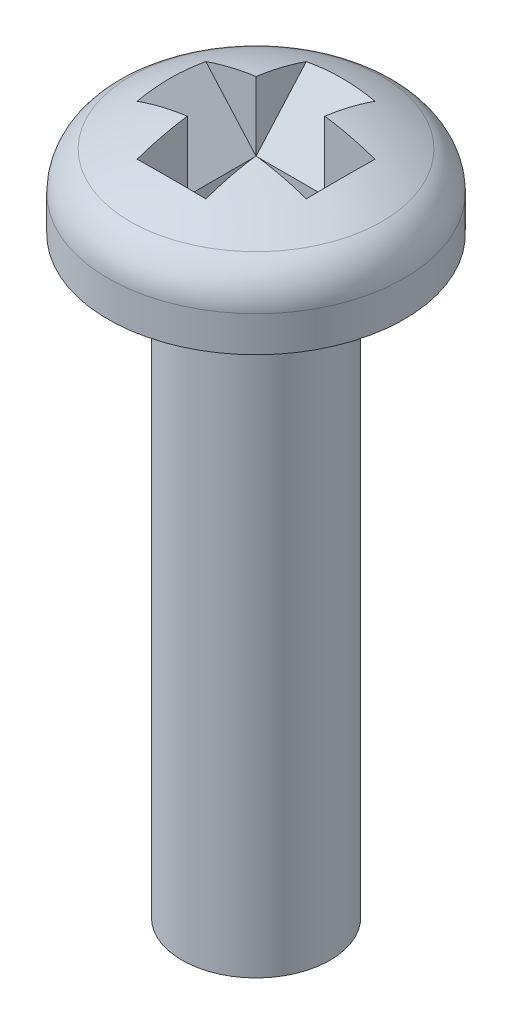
SolidWorks part; units mm, degrees
ref_plane "Plane1" through (0, 0, 0) normal (0, 0, 1) x (1, 0, 0)
ref_plane "Plane2" through (0, 0, 0) normal (0, 1, 0) x (1, 0, 0)
ref_plane "Plane3" through (0, 0, 0) normal (1, 0, 0) x (0, 0, -1)
sketch "Sketch1" plane through (0, 0, 0) normal (0, 0, 1) x (1, 0, 0)
  line L0 (0, 0) -> (3.175, 0)
  line L1 (3.175, 0) -> (3.175, 0.762)
  line L2 (0, 2.286) -> (0, 0)
  line L3 (0, 0) -> (0, 6.1523) construction
  arc A0 (3.175, 0.762) -> (2.6988, 1.5774) centre (2.2389, 0.762) ccw
  arc A1 (2.6988, 1.5774) -> (0, 2.286) centre (0, -3.2074) ccw
  dimension "D3" = 0.9361
  dimension "D1" = 3.175
  dimension "D2" = 1.524
  dimension "D4" = 0.762
revolve "Base-Revolve" add sketch "Sketch1" angle 360 about L3
sketch "Sketch2" plane through (0, 0, 0) normal (0, 0, 1) x (1, 0, 0)
  line L0 (0, 0) -> (0, 100) construction
  line L1 (0, -12.7) -> (1.5875, -12.7)
  line L2 (1.5875, -12.7) -> (1.5875, 0)
  line L3 (1.5875, 0) -> (0, 0)
  line L4 (0, 0) -> (0, -12.7)
  dimension "D1" = 12.7
  dimension "D2" = 1.5875
revolve "Boss-Revolve1" add sketch "Sketch2" angle 360 about L0
sketch "Sketch3" plane through (0, 0, 0) normal (0, 0, 1) x (1, 0, 0)
  line L0 (-4.0386, 6.6675) -> (4.0386, 6.6675)
  line L1 (4.0386, 6.6675) -> (4.0386, 4.445)
  line L2 (4.0386, 4.445) -> (0, -0.127)
  line L3 (0, -0.127) -> (-4.0386, 4.445)
  line L4 (-4.0386, 4.445) -> (-4.0386, 6.6675)
extrude "Cut-Extrude1" cut sketch "Sketch3" against normal mid plane 1.4732
sketch "Sketch4" plane through (0, 0, 0) normal (1, 0, 0) x (0, 0, -1)
  line L0 (-4.0386, 6.6675) -> (4.0386, 6.6675)
  line L1 (4.0386, 6.6675) -> (4.0386, 4.445)
  line L2 (4.0386, 4.445) -> (0, -0.127)
  line L3 (0, -0.127) -> (-4.0386, 4.445)
  line L4 (-4.0386, 4.445) -> (-4.0386, 6.6675)
extrude "Cut-Extrude2" cut sketch "Sketch4" against normal mid plane 1.4732
